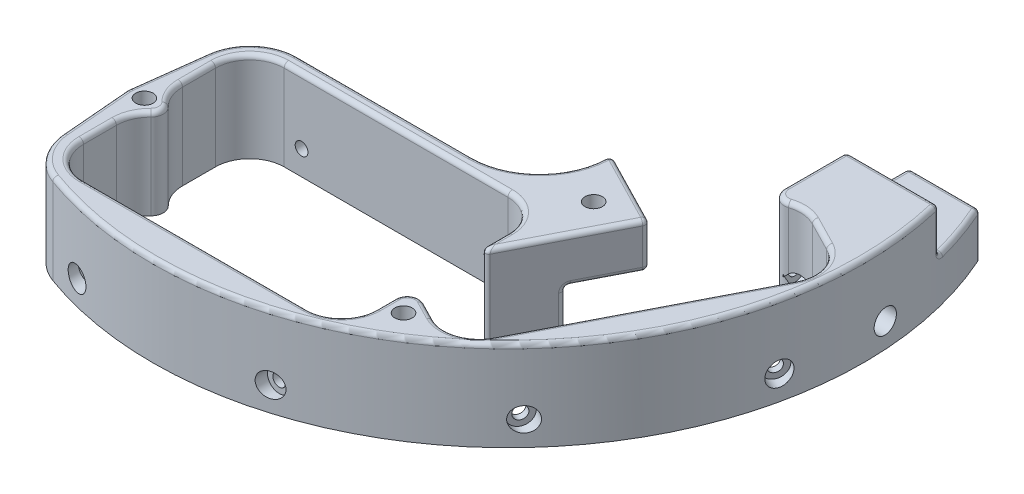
SolidWorks part; units mm, degrees
ref_plane "Front Plane" through (0, 0, 0) normal (0, 0, 1) x (1, 0, 0)
ref_plane "Top Plane" through (0, 0, 0) normal (0, 1, 0) x (1, 0, 0)
ref_plane "Right Plane" through (0, 0, 0) normal (1, 0, 0) x (0, 0, -1)
sketch "Sketch1" plane through (0, 0, 0) normal (0, 1, 0) x (1, 0, 0)
  circle A0 centre (0, 0) radius 100.33
  dimension "D1" = 200.66
extrude "Boss-Extrude1" add sketch "Sketch1" along normal blind 25.4
sketch "Sketch2" plane through (0, 0, 0) normal (0, -1, 0) x (1, 0, 0)
  line L1194 (43.561, -80.8482) -> (43.561, -71.5518)
  line L1195 (33.8582, -61.849) -> (-29.2862, -61.849)
  line L1196 (-38.989, -71.5518) -> (-38.989, -80.8482)
  line L1197 (-29.2862, -90.551) -> (33.8582, -90.551)
  line L1224 (43.561, -80.8482) -> (43.561, -71.5518)
  line L1226 (-38.989, -71.5518) -> (-38.989, -80.8482)
  line L1227 (-29.2862, -90.551) -> (33.8582, -90.551)
  line L1251 (-38.989, -43.6118) -> (-38.989, -52.9082)
  line L1252 (-29.2862, -62.611) -> (33.8582, -62.611)
  line L1253 (43.561, -52.9082) -> (43.561, -43.6118)
  line L1254 (33.8582, -33.909) -> (-29.2862, -33.909)
  line L1255 (-38.989, -43.6118) -> (-38.989, -52.9082)
  line L1258 (33.8582, -33.909) -> (-29.2862, -33.909)
  line L1263 (61.7982, 8.255) -> (52.5018, 8.255)
  line L1264 (42.799, -1.4478) -> (42.799, -64.5922)
  line L1269 (52.5018, -74.295) -> (61.7982, -74.295)
  line L1270 (71.501, -64.5922) -> (71.501, -1.4478)
  line L1271 (61.7982, 8.255) -> (52.5018, 8.255)
  line L1272 (42.799, -1.4478) -> (42.799, -39.8427)
  line L1273 (52.5018, -74.295) -> (61.7982, -74.295)
  line L1274 (71.501, -64.5922) -> (71.501, -1.4478)
  line L1279 (53.8496, 75.1323) -> (45.5815, 70.8824)
  line L1280 (41.3877, 57.8172) -> (70.2548, 1.6575)
  line L1281 (83.3201, -2.5363) -> (91.5881, 1.7137)
  line L1282 (95.7819, 14.7789) -> (66.9148, 70.9386)
  line L1283 (53.8496, 75.1323) -> (45.5815, 70.8824)
  line L1284 (43.5331, 53.6434) -> (68.0269, 5.9918)
  line L1285 (83.3201, -2.5363) -> (91.5881, 1.7137)
  line L1286 (95.7819, 14.7789) -> (66.9148, 70.9386)
  line L1291 (-38.989, 80.8482) -> (-38.989, 71.5518)
  line L1292 (-29.2862, 61.849) -> (33.8582, 61.849)
  line L1293 (43.561, 71.5518) -> (43.561, 80.8482)
  line L1294 (33.8582, 90.551) -> (-29.2862, 90.551)
  line L1295 (-38.989, 80.8482) -> (-38.989, 71.5518)
  line L1297 (43.561, 71.5518) -> (43.561, 80.8482)
  line L1298 (33.8582, 90.551) -> (-29.2862, 90.551)
  line L1303 (43.561, 43.6118) -> (43.561, 52.9082)
  line L1304 (33.8582, 62.611) -> (-29.2862, 62.611)
  line L1305 (-38.989, 52.9082) -> (-38.989, 43.6118)
  line L1306 (-29.2862, 33.909) -> (33.8582, 33.909)
  line L1307 (43.561, 43.6118) -> (43.561, 52.9082)
  line L1309 (-38.989, 52.9082) -> (-38.989, 43.6118)
  line L1310 (-29.2862, 33.909) -> (33.8582, 33.909)
  arc A0 (43.5607, -71.4799) -> (45.1255, -70.8958) centre (44.4497, -71.4733) cw
  arc A1461 (33.8582, -90.551) -> (43.561, -80.8482) centre (33.8582, -80.8482) ccw
  arc A1462 (43.561, -71.5518) -> (33.8582, -61.849) centre (33.8582, -71.5518) ccw
  arc A1463 (-29.2862, -61.849) -> (-38.989, -71.5518) centre (-29.2862, -71.5518) ccw
  arc A1464 (-38.989, -80.8482) -> (-29.2862, -90.551) centre (-29.2862, -80.8482) ccw
  arc A1470 (33.8582, -90.551) -> (43.561, -80.8482) centre (33.8582, -80.8482) ccw
  arc A1471 (43.561, -71.5518) -> (43.5607, -71.4799) centre (33.8582, -71.5518) ccw
  arc A1472 (-31.9785, -62.23) -> (-38.989, -71.5518) centre (-29.2862, -71.5518) ccw
  arc A1473 (-38.989, -80.8482) -> (-29.2862, -90.551) centre (-29.2862, -80.8482) ccw
  arc A1514 (-29.2862, -33.909) -> (-38.989, -43.6118) centre (-29.2862, -43.6118) ccw
  arc A1515 (-38.989, -52.9082) -> (-29.2862, -62.611) centre (-29.2862, -52.9082) ccw
  arc A1516 (33.8582, -62.611) -> (43.561, -52.9082) centre (33.8582, -52.9082) ccw
  arc A1517 (43.561, -43.6118) -> (33.8582, -33.909) centre (33.8582, -43.6118) ccw
  arc A1542 (-29.2862, -33.909) -> (-38.989, -43.6118) centre (-29.2862, -43.6118) ccw
  arc A1543 (-38.989, -52.9082) -> (-31.9785, -62.23) centre (-29.2862, -52.9082) ccw
  arc A1545 (42.799, -39.8427) -> (33.8582, -33.909) centre (33.8582, -43.6118) ccw
  arc A1550 (71.501, -1.4478) -> (61.7982, 8.255) centre (61.7982, -1.4478) ccw
  arc A1551 (52.5018, 8.255) -> (42.799, -1.4478) centre (52.5018, -1.4478) ccw
  arc A1552 (42.799, -64.5922) -> (52.5018, -74.295) centre (52.5018, -64.5922) ccw
  arc A1553 (61.7982, -74.295) -> (71.501, -64.5922) centre (61.7982, -64.5922) ccw
  arc A1554 (71.501, -1.4478) -> (71.4052, -0.088) centre (61.7982, -1.4478) ccw
  arc A1555 (52.5018, 8.255) -> (42.799, -1.4478) centre (52.5018, -1.4478) ccw
  arc A1556 (45.1255, -70.8958) -> (52.5018, -74.295) centre (52.5018, -64.5922) ccw
  arc A1557 (61.7982, -74.295) -> (71.501, -64.5922) centre (61.7982, -64.5922) ccw
  arc A1566 (66.9148, 70.9386) -> (53.8496, 75.1323) centre (58.2853, 66.5028) ccw
  arc A1567 (45.5815, 70.8824) -> (41.3877, 57.8172) centre (50.0172, 62.2529) ccw
  arc A1568 (70.2548, 1.6575) -> (83.3201, -2.5363) centre (78.8843, 6.0932) ccw
  arc A1569 (91.5881, 1.7137) -> (95.7819, 14.7789) centre (87.1524, 10.3432) ccw
  arc A1570 (66.9148, 70.9386) -> (53.8496, 75.1323) centre (58.2853, 66.5028) ccw
  arc A1571 (45.5815, 70.8824) -> (43.2805, 69.2358) centre (50.0172, 62.2529) ccw
  arc A1572 (71.4052, -0.088) -> (83.3201, -2.5363) centre (78.8843, 6.0932) ccw
  arc A1573 (91.5881, 1.7137) -> (95.7819, 14.7789) centre (87.1524, 10.3432) ccw
  arc A1578 (-29.2862, 90.551) -> (-38.989, 80.8482) centre (-29.2862, 80.8482) ccw
  arc A1579 (-38.989, 71.5518) -> (-29.2862, 61.849) centre (-29.2862, 71.5518) ccw
  arc A1580 (33.8582, 61.849) -> (43.561, 71.5518) centre (33.8582, 71.5518) ccw
  arc A1581 (43.561, 80.8482) -> (33.8582, 90.551) centre (33.8582, 80.8482) ccw
  arc A1582 (-29.2862, 90.551) -> (-38.989, 80.8482) centre (-29.2862, 80.8482) ccw
  arc A1583 (-38.989, 71.5518) -> (-31.9785, 62.23) centre (-29.2862, 71.5518) ccw
  arc A1584 (43.2805, 69.2358) -> (43.561, 71.5518) centre (33.8582, 71.5518) ccw
  arc A1585 (43.561, 80.8482) -> (33.8582, 90.551) centre (33.8582, 80.8482) ccw
  arc A1586 (68.0269, 5.9918) -> (61.7982, 8.255) centre (61.7982, -1.4478) ccw
  arc A1590 (33.8582, 33.909) -> (43.561, 43.6118) centre (33.8582, 43.6118) ccw
  arc A1591 (43.561, 52.9082) -> (33.8582, 62.611) centre (33.8582, 52.9082) ccw
  arc A1592 (-29.2862, 62.611) -> (-38.989, 52.9082) centre (-29.2862, 52.9082) ccw
  arc A1593 (-38.989, 43.6118) -> (-29.2862, 33.909) centre (-29.2862, 43.6118) ccw
  arc A1594 (33.8582, 33.909) -> (43.561, 43.6118) centre (33.8582, 43.6118) ccw
  arc A1595 (43.561, 52.9082) -> (43.5331, 53.6434) centre (33.8582, 52.9082) ccw
  arc A1596 (-31.9785, 62.23) -> (-38.989, 52.9082) centre (-29.2862, 52.9082) ccw
  arc A1597 (-38.989, 43.6118) -> (-29.2862, 33.909) centre (-29.2862, 43.6118) ccw
  dimension "D7" = 0.889
  dimension "D1" = 0.381
  dimension "D2" = 0.381
  dimension "D3" = 0.381
  dimension "D4" = 0.381
  dimension "D5" = 0.381
  dimension "D6" = 0.381
extrude "Cut-Extrude1" cut sketch "Sketch2" against normal through all
sketch "Sketch3" plane through (0, 25.4, 0) normal (0, 1, 0) x (1, 0, 0)
  line L1 (-43.5773, 82.0435) -> (-45.1958, 62.6922)
  line L2 (-45.1768, 61.7698) -> (-42.6944, 41.9338)
  line L3 (-42.6944, -41.9338) -> (-45.1768, -61.7698)
  line L4 (-45.1958, -62.6922) -> (-43.5773, -82.0435)
  line L43 (33.8582, 33.909) -> (-29.2862, 33.909) construction
  line L44 (42.799, 1.4478) -> (42.799, 39.8427) construction
  line L45 (-29.2862, -33.909) -> (33.8582, -33.909) construction
  line L174 (19.939, -30.099) -> (-29.2862, -30.099)
  line L177 (38.989, 11.049) -> (38.989, -11.049)
  line L178 (-29.2862, 30.099) -> (19.939, 30.099)
  circle A1 centre (0, 0) radius 100.33 construction
  arc A6 (-34.1705, 94.3318) -> (-34.1705, -94.3318) centre (0, 0) ccw
  arc A7 (-34.1705, 94.3318) -> (-43.5773, 82.0435) centre (-29.2862, 80.8482) ccw
  arc A10 (-45.1958, 62.6922) -> (-45.1768, 61.7698) centre (-40.7662, 62.3217) ccw
  arc A11 (-45.1768, -61.7698) -> (-45.1958, -62.6922) centre (-40.7662, -62.3217) ccw
  arc A12 (38.989, -11.049) -> (19.939, -30.099) centre (19.939, -11.049) cw
  arc A13 (38.989, 11.049) -> (19.939, 30.099) centre (19.939, 11.049) ccw
  arc A14 (-38.989, 43.6118) -> (-29.2862, 33.909) centre (-29.2862, 43.6118) ccw construction
  arc A15 (-29.2862, 90.551) -> (-38.989, 80.8482) centre (-29.2862, 80.8482) ccw construction
  arc A17 (-29.2862, -33.909) -> (-38.989, -43.6118) centre (-29.2862, -43.6118) ccw construction
  arc A18 (-38.989, -80.8482) -> (-29.2862, -90.551) centre (-29.2862, -80.8482) ccw construction
  arc A168 (-29.2862, -30.099) -> (-42.6944, -41.9338) centre (-29.2862, -43.6118) ccw
  arc A173 (-42.6944, 41.9338) -> (-29.2862, 30.099) centre (-29.2862, 43.6118) ccw
  arc A184 (-43.5773, -82.0435) -> (-34.1705, -94.3318) centre (-29.2862, -80.8482) ccw
  point P24 (-45.2344, 62.23)
  point P27 (-45.2344, -62.23)
  dimension "D2" = 2.54
  dimension "D3" = 4.445
  dimension "D4" = 19.05
  dimension "D5" = 3.81
  dimension "D1" = 3.81
  dimension "D6" = 3.81
extrude "Cut-Extrude5" cut sketch "Sketch3" against normal through all
hole_wizard "#10 (0.1935) Diameter Hole1" positions "Sketch4" profile "Sketch5" hole size "#10" standard "ANSI Inch"
sketch "Sketch4" plane through (0, 25.4, 0) normal (0, 1, 0) x (1, 0, 0)
  line L2 (43.561, 80.8482) -> (43.561, 71.5518) construction
  line L5 (71.501, 64.5922) -> (71.501, 1.4478) construction
  line L6 (71.501, 33.02) -> (94.7406, 33.02) construction
  line L7 (53.8496, -75.1323) -> (45.5815, -70.8824) construction
  line L8 (43.561, -71.5518) -> (43.561, -80.8482) construction
  line L9 (38.989, -11.049) -> (38.989, 11.049) construction
  line L10 (43.5331, -53.6434) -> (68.0269, -5.9918) construction
  circle A1 centre (-40.4114, -62.23) radius 4.8115 construction
  arc A2 (-38.989, -52.9082) -> (-31.9785, -62.23) centre (-29.2862, -52.9082) ccw construction
  arc A3 (-31.9785, -62.23) -> (-38.989, -71.5518) centre (-29.2862, -71.5518) ccw construction
  circle A7 centre (48.641, 78.8619) radius 5.08 construction
  arc A8 (-34.1705, -94.3318) -> (-34.1705, 94.3318) centre (0, 0) ccw construction
  arc A9 (52.5018, 74.295) -> (45.1255, 70.8958) centre (52.5018, 64.5922) ccw construction
  circle A10 centre (82.7428, 33.02) radius 11.2418 construction
  circle A13 centre (48.2692, -24.13) radius 9.2802 construction
  circle A14 centre (48.641, -78.1669) radius 5.08 construction
  circle A19 centre (-40.4114, 62.23) radius 4.8115 construction
  arc A20 (-31.9785, 62.23) -> (-38.989, 52.9082) centre (-29.2862, 52.9082) ccw construction
  arc A21 (-38.989, 71.5518) -> (-31.9785, 62.23) centre (-29.2862, 71.5518) ccw construction
  arc A27 (-45.1958, 62.6922) -> (-45.1768, 61.7698) centre (-40.7662, 62.3217) ccw construction
  arc A28 (-45.1768, -61.7698) -> (-45.1958, -62.6922) centre (-40.7662, -62.3217) ccw construction
  point P0 (-40.4114, -62.23)
  point P2 (-40.4114, 62.23)
  point P4 (48.2692, -24.13)
  point P6 (48.641, -78.1669)
  point P8 (48.641, 78.8619)
  point P10 (82.7428, 33.02)
  dimension "D1" = 9.623
  dimension "D4" = 9.623
  dimension "D5" = 10.16
  dimension "D3" = 24.13
sketch "Sketch5" plane through (-40.4114, 25.4, 62.23) normal (1, 0, 0) x (0, 0, 1)
  line L0 (0, 0) -> (0, 25.4)
  line L1 (0, 25.4) -> (2.4574, 25.4)
  line L2 (2.4574, 25.4) -> (2.4574, 0)
  line L5 (2.4574, 0) -> (0, 0)
  line L11 (0, -6.35) -> (0, 107.95) construction
  dimension "Thru Hole Dia." = 4.9149
  dimension "Thru Hole Depth" = 25.4
fillet "Fillet1" radius 3.429 6 edges at (-31.9785, 12.7, -62.23) (-31.9785, 12.7, 62.23) (43.2805, 12.7, 69.2358) (71.4052, 12.7, -0.088) (68.0269, 12.7, 5.9918) (42.799, 12.7, -39.8427)
sketch "Sketch6" plane through (0, 0, 0) normal (0, -1, 0) x (1, 0, 0)
  line L0 (43.561, 43.6118) -> (43.561, 52.9082) construction
  line L1 (43.5331, 53.6434) -> (64.2952, 13.2516) construction
  line L8 (43.5331, 53.6434) -> (64.2952, 13.2516)
  line L9 (43.561, 43.6118) -> (43.561, 52.9082)
  line L10 (43.5331, 53.6434) -> (45.2407, 50.3214)
  line L11 (43.561, 49.915) -> (43.561, 52.9082)
  arc A0 (43.561, 49.915) -> (45.2407, 50.3214) centre (44.45, 49.915) cw
  arc A4 (43.561, 52.9082) -> (43.5331, 53.6434) centre (33.8582, 52.9082) ccw
  arc A5 (43.561, 52.9082) -> (43.5331, 53.6434) centre (33.8582, 52.9082) ccw
  dimension "D1" = 0.889
  dimension "D2" = 0
extrude "Cut-Extrude6" cut sketch "Sketch6" against normal through all
ref_plane "Plane1" through (0, 0, 100.33) normal (0, 0, 1) x (1, 0, 0)
ref_plane "Plane2" through (89.2319, 0, 45.8669) normal (0.8894, 0, 0.4572) x (0.4572, 0, -0.8894)
ref_plane "Plane3" through (100.33, 0, 0) normal (1, 0, 0) x (0, 0, -1)
ref_plane "Plane4" through (0, 0, -100.33) normal (0, 0, -1) x (-1, 0, 0)
hole_wizard "CBORE for M3 SBHCS1" positions "Sketch7" profile "Sketch8" counterbore size "M3" standard "ANSI Metric"
sketch "Sketch7" plane through (0, 0, 100.33) normal (0, 0, 1) x (1, 0, 0)
  circle A0 centre (-24.384, 6.9088) radius 2.7686 construction
  circle A1 centre (28.956, 6.9088) radius 2.7686 construction
  point P0 (-24.384, 6.9088)
  point P2 (28.956, 6.9088)
sketch "Sketch8" plane through (-24.384, 6.9088, 100.33) normal (1, 0, 0) x (0, -1, 0)
  line L0 (0, 0) -> (0, 9.779)
  line L1 (0, 9.779) -> (1.8, 9.779)
  line L2 (-18.4912, 9.779) -> (6.9088, 9.779) construction
  line L3 (1.8, 9.779) -> (1.8, 6.779)
  line L4 (1.8, 6.779) -> (3.35, 6.779)
  line L5 (3.35, 6.779) -> (3.35, 0)
  line L7 (3.35, 0) -> (0, 0)
  line L11 (0, -6.35) -> (0, 107.95) construction
  dimension "Thru Hole Dia." = 3.6
  dimension "Thru Hole Depth" = 9.779
  dimension "C'Bore Dia." = 6.7
hole_wizard "CBORE for M3 SBHCS2" positions "Sketch9" profile "Sketch10" counterbore size "M3" standard "ANSI Metric"
sketch "Sketch9" plane through (89.2319, 0, 45.8669) normal (0.8894, 0, 0.4572) x (0.4572, 0, -0.8894)
  circle A0 centre (-27.5987, 6.9088) radius 2.7686 construction
  circle A1 centre (25.7413, 6.9088) radius 2.7686 construction
  point P0 (-27.5987, 6.9088)
  point P2 (25.7413, 6.9088)
sketch "Sketch10" plane through (76.6149, 6.9088, 70.4127) normal (0, 1, 0) x (0.4572, 0, -0.8894)
  line L0 (0, 0) -> (0, 8.3867)
  line L1 (0, 8.3867) -> (1.8, 8.3867)
  line L2 (58.2422, 8.3867) -> (-4.9022, 8.3867) construction
  line L3 (1.8, 8.3867) -> (1.8, 6.3867)
  line L4 (1.8, 6.3867) -> (3.35, 6.3867)
  line L5 (3.35, 6.3867) -> (3.35, 0)
  line L7 (3.35, 0) -> (0, 0)
  line L11 (0, -6.35) -> (0, 107.95) construction
  dimension "Thru Hole Dia." = 3.6
  dimension "Thru Hole Depth" = 8.3867
  dimension "C'Bore Dia." = 6.7
hole_wizard "CBORE for M3 SBHCS3" positions "Sketch11" profile "Sketch12" counterbore size "M3" standard "ANSI Metric"
sketch "Sketch11" plane through (100.33, 0, 0) normal (1, 0, 0) x (0, 0, -1)
  circle A1 centre (6.35, 6.9088) radius 2.7686 construction
  circle A2 centre (59.69, 6.9088) radius 2.7686 construction
  point P0 (6.35, 6.9088)
  point P2 (59.69, 6.9088)
sketch "Sketch12" plane through (100.33, 6.9088, -6.35) normal (0, 1, 0) x (0, 0, -1)
  line L0 (0, 0) -> (0, 29.9096)
  line L1 (0, 29.9096) -> (1.8, 28.8281)
  line L2 (1.8, 28.8281) -> (1.8, 25.829)
  line L3 (1.8, 25.829) -> (3.35, 25.829)
  line L4 (3.35, 25.829) -> (3.35, 0)
  line L5 (3.35, 0) -> (0, 0)
  line L6 (58.2422, 28.829) -> (0.079, 28.829) construction
  line L10 (0, 29.9096) -> (-1.8, 28.8281) construction
  line L11 (0, -6.35) -> (0, 107.95) construction
  dimension "Hole Dia." = 3.6
  dimension "Hole Depth" = 28.8281
  dimension "C'Bore Dia." = 6.7
  dimension "Drill Angle" = 118
hole_wizard "CBORE for M3 SBHCS4" positions "Sketch13" profile "Sketch14" counterbore size "M3" standard "ANSI Metric"
sketch "Sketch13" plane through (0, 0, -100.33) normal (0, 0, -1) x (-1, 0, 0)
  circle A0 centre (-28.956, 6.9088) radius 2.7686 construction
  circle A1 centre (24.384, 6.9088) radius 2.7686 construction
  point P0 (-28.956, 6.9088)
  point P2 (24.384, 6.9088)
sketch "Sketch14" plane through (28.956, 6.9088, -100.33) normal (1, 0, 0) x (0, 1, 0)
  line L0 (0, 0) -> (0, 9.779)
  line L1 (0, 9.779) -> (1.8, 9.779)
  line L2 (18.4912, 9.779) -> (-6.9088, 9.779) construction
  line L3 (1.8, 9.779) -> (1.8, 6.779)
  line L4 (1.8, 6.779) -> (3.35, 6.779)
  line L5 (3.35, 6.779) -> (3.35, 0)
  line L7 (3.35, 0) -> (0, 0)
  line L11 (0, -6.35) -> (0, 107.95) construction
  dimension "Thru Hole Dia." = 3.6
  dimension "Thru Hole Depth" = 9.779
  dimension "C'Bore Dia." = 6.7
hole_wizard "CBORE for M3 SBHCS5" positions "Sketch15" profile "Sketch16" counterbore size "M3" standard "ANSI Metric"
sketch "Sketch15" plane through (0, 0, 0) normal (0, 0, 1) x (1, 0, 0)
  circle A0 centre (28.956, 6.9088) radius 2.7686 construction
  circle A1 centre (-24.384, 6.9088) radius 2.7686 construction
  point P0 (-24.384, 6.9088)
  point P2 (28.956, 6.9088)
sketch "Sketch16" plane through (-24.384, 6.9088, 0) normal (1, 0, 0) x (0, 1, 0)
  line L0 (0, 0) -> (0, 33.909)
  line L1 (0, 33.909) -> (1.8, 33.909)
  line L2 (18.4912, 33.909) -> (-6.9088, 33.909) construction
  line L3 (1.8, 33.909) -> (1.8, 30.909)
  line L4 (1.8, 30.909) -> (3.35, 30.909)
  line L5 (3.35, 30.909) -> (3.35, 0)
  line L7 (3.35, 0) -> (0, 0)
  line L11 (0, -6.35) -> (0, 107.95) construction
  dimension "Thru Hole Dia." = 3.6
  dimension "Thru Hole Depth" = 33.909
  dimension "C'Bore Dia." = 6.7
hole_wizard "CBORE for M3 SBHCS6" positions "Sketch17" profile "Sketch18" counterbore size "M3" standard "ANSI Metric"
sketch "Sketch17" plane through (0, 0, 0) normal (0, 0, 1) x (1, 0, 0)
  circle A0 centre (-24.384, 6.9088) radius 2.7686 construction
  circle A1 centre (28.956, 6.9088) radius 2.7686 construction
  point P0 (-24.384, 6.9088)
  point P2 (28.956, 6.9088)
sketch "Sketch18" plane through (-24.384, 6.9088, 0) normal (1, 0, 0) x (0, -1, 0)
  line L0 (0, 0) -> (0, 33.909)
  line L1 (0, 33.909) -> (1.8, 33.909)
  line L2 (-18.4912, 33.909) -> (6.9088, 33.909) construction
  line L3 (1.8, 33.909) -> (1.8, 30.909)
  line L4 (1.8, 30.909) -> (3.35, 30.909)
  line L5 (3.35, 30.909) -> (3.35, 0)
  line L7 (3.35, 0) -> (0, 0)
  line L11 (0, -6.35) -> (0, 107.95) construction
  dimension "Thru Hole Dia." = 3.6
  dimension "Thru Hole Depth" = 33.909
  dimension "C'Bore Dia." = 6.7
fillet "Fillet2" radius 1.27 61 edges at (44.1388, 25.4, -70.6405) (43.561, 25.4, -76.2) (-40.6737, 25.4, 89.5654) (-44.3865, 25.4, 72.3678) (-45.2103, 25.4, 62.2305) (-43.9356, 25.4, 51.8518) (-38.2283, 25.4, 33.4809) (-4.6736, 25.4, 30.099) (33.4094, 25.4, 24.5194) (38.989, 25.4, 0) (33.4094, 25.4, -24.5194) (-4.6736, 25.4, -30.099) (-38.2283, 25.4, -33.4809) (-43.9356, 25.4, -51.8518) (-45.2103, 25.4, -62.2305) (-44.3865, 25.4, -72.3678) (-40.6737, 25.4, -89.5654) (40.7191, 25.4, 87.7091) (43.561, 25.4, 78.155) (45.2036, 25.4, 72.535) (51.2036, 25.4, 73.7723) (61.2507, 25.4, 75.7414) (81.3484, 25.4, 42.8587) (96.3909, 25.4, 7.3777) (87.4541, 25.4, -0.4113) (79.7029, 25.4, -3.575) (72.903, 25.4, -3.6633) (71.501, 25.4, -35.5106) (68.6591, 25.4, -71.4531) (57.15, 25.4, -74.295) (48.4409, 25.4, -73.4043) (40.7191, 25.4, -87.7091) (2.286, 25.4, -90.551) (-36.1471, 25.4, -87.7091) (-38.989, 25.4, -76.2) (-38.2431, 25.4, -67.8212) (-35.1064, 25.4, -62.23) (-38.2431, 25.4, -56.6388) (-38.989, 25.4, -48.26) (-36.1471, 25.4, -36.7509) (2.286, 25.4, -33.909) (35.9432, 25.4, -34.1357) (41.217, 25.4, -34.5818) (42.799, 25.4, -16.5703) (45.6409, 25.4, 5.4131) (56.8737, 25.4, 8.255) (64.1724, 25.4, 9.8976) (54.7679, 25.4, 31.7865) (44.2409, 25.4, 50.779) (43.561, 25.4, 46.7634) (40.7191, 25.4, 36.7509) (2.286, 25.4, 33.909) (-36.1471, 25.4, 36.7509) (-38.989, 25.4, 48.26) (-38.2431, 25.4, 56.6388) (-35.1064, 25.4, 62.23) (-38.2431, 25.4, 67.8212) (-38.989, 25.4, 76.2) (-36.1471, 25.4, 87.7091) (100.33, 25.4, 0) (2.286, 25.4, 90.551)
sketch "Sketch19" [suppressed] plane through (56.2458, 0, 28.9114) normal (0.8894, 0, 0.4572) x (0.4572, 0, -0.8894)
  line L0 (-24.0728, 0) -> (17.6075, 0) construction
  line L1 (-135.2016, 0) -> (21.0365, 0)
  line L3 (-8.2016, 12.446) -> (21.0365, 12.446)
  line L4 (21.0365, 0) -> (21.0365, 12.446)
  line L5 (21.0365, 0) -> (21.0365, 24.13) construction
  line L6 (6.0236, 25.4) -> (6.0236, 0) construction
  line L7 (6.0236, 12.7) -> (25.1507, 12.7) construction
  line L8 (-22.4982, 25.4) -> (17.6075, 25.4) construction
  line L10 (-8.2016, 12.446) -> (-8.2016, 25.4)
  line L11 (-1.8516, 25.4) -> (-1.8516, 0) construction
  line L12 (-8.2016, 25.4) -> (-135.2016, 25.4)
  line L13 (-135.2016, 25.4) -> (-135.2016, 0)
  dimension "D1" = 0.254
  dimension "D2" = 6.35
  dimension "D3" = 127
sketch "Sketch21" plane through (0, 25.4, 0) normal (0, 1, 0) x (1, 0, 0)
  line L0 (71.501, -26.4543) -> (38.9425, -9.7186)
  line L1 (64.2952, -13.2516) -> (45.2407, -50.3214) construction
  line L2 (38.9425, -9.7186) -> (-99.8582, -9.7186)
  line L3 (71.501, 41.5734) -> (91.3113, 41.5734)
  line L4 (71.501, 6.429) -> (71.501, 64.5922) construction
  line L5 (71.501, 41.5734) -> (71.501, -26.4543)
  arc A0 (91.3113, 41.5734) -> (-99.8582, -9.7186) centre (0, 0) ccw
  arc A1 (-34.1705, -94.3318) -> (-34.1705, 94.3318) centre (0, 0) ccw construction
  arc A2 (19.939, -30.099) -> (38.989, -11.049) centre (19.939, -11.049) ccw construction
  circle A3 centre (48.2692, -24.13) radius 2.4574 construction
  circle A5 centre (82.7428, 33.02) radius 2.4574 construction
  dimension "D1" = 6.096
  dimension "D2" = 6.096
extrude "Cut-Extrude7" cut sketch "Sketch21" against normal through all
sketch "Sketch22" plane through (56.2458, 0, 28.9114) normal (0.8894, 0, 0.4572) x (0.4572, 0, -0.8894)
  line L0 (-8.4556, 0) -> (-8.4556, 25.4) construction
  line L1 (9.1593, 0) -> (-8.4556, 0)
  line L2 (9.1593, 0) -> (9.1593, 12.7762)
  line L3 (9.1593, 12.7762) -> (-8.4556, 12.7762)
  line L4 (-8.4556, 0) -> (-8.4556, 12.7762)
  line L5 (-22.4982, 25.4) -> (9.1593, 25.4) construction
  line L6 (-8.4556, 12.7) -> (17.0716, 12.7) construction
  line L7 (-1.8516, 25.4) -> (-1.8516, 0) construction
  dimension "D1" = 0.0762
  dimension "D2" = 6.604
extrude "Cut-Extrude8" cut sketch "Sketch22" against normal through all
sketch "Sketch25" plane through (71.501, 0, 0) normal (-1, 0, 0) x (0, 0, 1)
  line L0 (-23.9586, 25.4) -> (-23.9585, 0) construction
  line L1 (-41.5734, 25.4) -> (-23.9586, 25.4)
  line L2 (-41.5734, 25.4) -> (-41.5734, 12.6619)
  line L3 (-41.5734, 12.6619) -> (-23.9586, 12.6619)
  line L4 (-23.9586, 25.4) -> (-23.9586, 12.6619)
  line L5 (-41.5734, 0) -> (-6.429, 0) construction
  line L6 (-23.9586, 12.7) -> (-52.2783, 12.7) construction
  line L7 (-30.5626, 0) -> (-30.5626, 25.4) construction
  dimension "D1" = 0.0762
  dimension "D2" = 6.604
extrude "Cut-Extrude13" cut sketch "Sketch25" against normal through all
sketch "Sketch23" [suppressed] plane through (0, 25.4, 0) normal (0, 1, 0) x (1, 0, 0)
  line L0 (32.3039, -25.5408) -> (71.501, -45.6889)
  line L1 (71.501, 24.4666) -> (97.3011, 24.4666)
  line L2 (64.2952, -13.2516) -> (45.2407, -50.3214) construction
  line L3 (32.3039, -25.5408) -> (-97.0246, -25.5408)
  line L4 (71.501, 6.429) -> (71.501, 64.5922) construction
  line L5 (71.501, 24.4666) -> (71.501, -45.6889)
  arc A0 (-97.0246, -25.5408) -> (97.3011, 24.4666) centre (0, 0) ccw
  arc A1 (-34.1705, -94.3318) -> (-34.1705, 94.3318) centre (0, 0) ccw construction
  circle A2 centre (48.2692, -24.13) radius 2.4574 construction
  arc A3 (19.939, -30.099) -> (38.989, -11.049) centre (19.939, -11.049) ccw construction
  circle A5 centre (82.7428, 33.02) radius 2.4574 construction
  dimension "D1" = 6.096
  dimension "D2" = 6.096
extrude "Cut-Extrude11" [suppressed] cut sketch "Sketch23" against normal through all
sketch "Sketch24" [suppressed] plane through (56.2458, 0, 28.9114) normal (0.8894, 0, 0.4572) x (0.4572, 0, -0.8894)
  line L0 (-7.9476, 24.13) -> (-7.9476, 0) construction
  line L1 (-7.9476, 12.6619) -> (9.6673, 12.6619)
  line L2 (-7.9476, 12.6619) -> (-7.9476, 25.4)
  line L3 (-7.9476, 25.4) -> (9.6673, 25.4)
  line L4 (9.6673, 12.6619) -> (9.6673, 25.4)
  line L5 (-7.9476, 25.4) -> (17.6075, 25.4) construction
  line L6 (3.0633, 0) -> (3.0633, 25.4) construction
  line L7 (9.6673, 25.4) -> (9.6673, 0) construction
  line L8 (-7.9476, 0) -> (17.6075, 0) construction
  line L9 (9.6673, 12.7) -> (-13.3825, 12.7) construction
  dimension "D1" = 6.604
  dimension "D2" = 0.0762
extrude "Cut-Extrude12" [suppressed] cut sketch "Sketch24" against normal blind 43.18
sketch "Sketch26" [suppressed] plane through (71.501, 0, 0) normal (-1, 0, 0) x (0, 0, 1)
  line L0 (-42.0814, 0) -> (-42.0814, 25.4) construction
  line L1 (-24.4666, 0) -> (-42.0814, 0)
  line L2 (-24.4666, 0) -> (-24.4666, 12.7762)
  line L3 (-24.4666, 12.7762) -> (-42.0814, 12.7762)
  line L4 (-42.0814, 0) -> (-42.0814, 12.7762)
  line L5 (-64.5922, 25.4) -> (-24.4666, 25.4) construction
  line L6 (-42.0814, 12.7) -> (-15.3757, 12.7) construction
  line L7 (-24.4666, 0) -> (-24.4666, 24.13) construction
  line L8 (-35.4774, 25.4) -> (-35.4774, 0) construction
  dimension "D1" = 0.0762
  dimension "D2" = 6.604
extrude "Cut-Extrude14" [suppressed] cut sketch "Sketch26" against normal through all
fillet "Fillet3" [suppressed] radius 1.27
fillet "Fillet4" [suppressed] radius 1.27
fillet "Fillet5" [suppressed] radius 1.27
fillet "Fillet6" radius 1.27 11 edges at (84.445, 25.4, -23.9586) (96.9121, 25.1402, -23.9586) (71.873, 25.028, -23.9586) (97.4274, 18.3959, -23.9585) (71.501, 18.3959, -23.9586) (71.501, 6.3309, -41.5734) (84.4642, 12.6619, -23.9585) (71.501, 12.6619, -32.766) (94.7795, 12.6619, -32.9084) (81.4062, 12.6619, -41.5734)
fillet "Fillet7" radius 1.27 9 edges at (52.3803, 6.3881, 36.4316) (38.989, 18.4531, 9.7426) (39.361, 25.028, 9.9338) (60.4331, 18.4531, 20.7652) (60.1023, 25.028, 20.5952) (49.7813, 25.4, 15.29) (56.4067, 12.7762, 28.5984) (42.1293, 12.7762, 31.1625) (49.711, 12.7762, 15.2539)
fillet "Fillet8" radius 1.27 4 edges at (39.8564, 13.1482, 10.6066) (31.8784, 10.0263, 25.8933) (32.2419, 12.4612, 25.5934) (37.2576, 12.7762, 18.9843)
